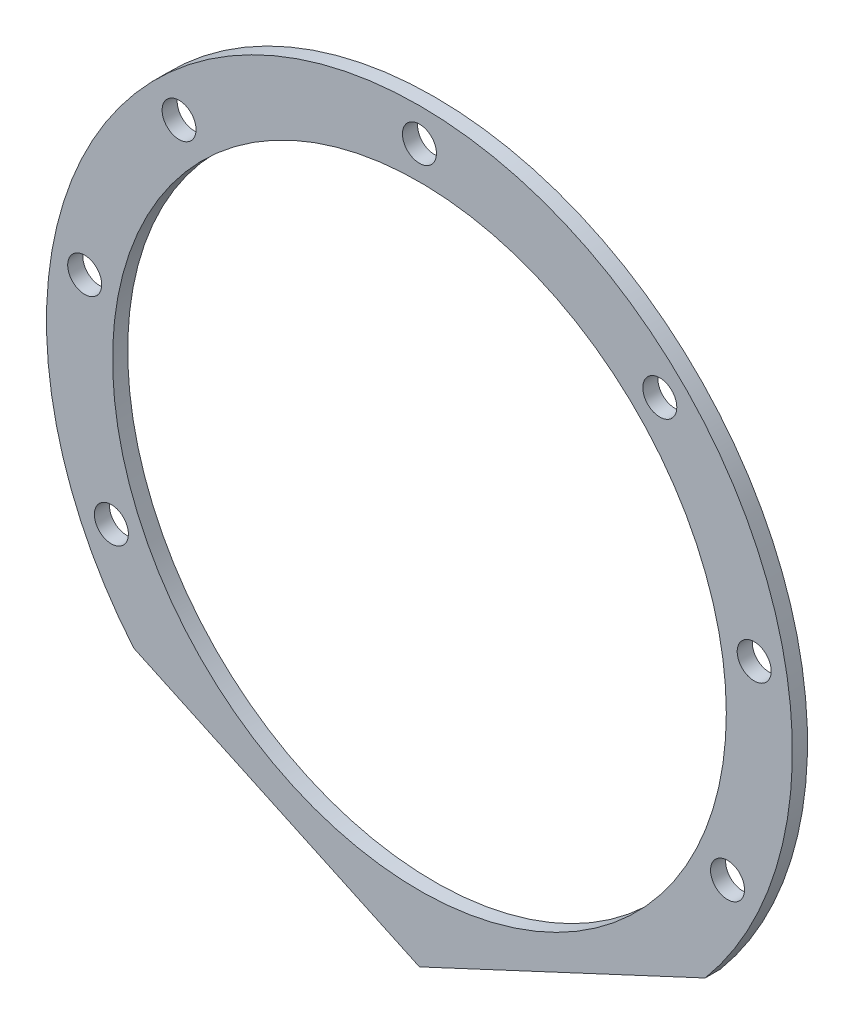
SolidWorks part; units mm, degrees
ref_plane "Plan de face" through (0, 0, 0) normal (0, 0, 1) x (1, 0, 0)
ref_plane "Plan de dessus" through (0, 0, 0) normal (0, 1, 0) x (1, 0, 0)
ref_plane "Plan de droite" through (0, 0, 0) normal (1, 0, 0) x (0, 0, -1)
sketch "Esquisse1" plane through (0, 0, 0) normal (0, 0, 1) x (1, 0, 0)
  line L0 (0, 230.6811) -> (0, -265.3328) construction
  line L1 (-230.6811, -197.5) -> (277.2134, -197.5) construction
  line L2 (0, 0) -> (-258.4766, -120.5296) construction
  line L3 (-260.3724, 45.9107) -> (0, 0) construction
  line L4 (0, 0) -> (-195.6754, 195.6754) construction
  line L5 (0, -197.5) -> (-173.1038, -116.7804)
  line L6 (0, -197.5) -> (173.1038, -116.7804)
  line L7 (0, 0) -> (195.6754, 195.6754) construction
  line L8 (260.3724, 45.9107) -> (0, 0) construction
  line L9 (0, 0) -> (258.4766, -120.5296) construction
  arc A0 (151.2938, -126.9506) -> (-151.2938, -126.9506) centre (0, 0) ccw
  circle A1 centre (0, 0) radius 162.5
  circle A2 centre (0, 0) radius 180 construction
  circle A3 centre (-163.1354, -76.0713) radius 9
  circle A4 centre (-177.2654, 31.2567) radius 9
  circle A5 centre (-127.2792, 127.2792) radius 9
  circle A6 centre (0, 180) radius 9
  circle A7 centre (163.1354, -76.0713) radius 9
  circle A8 centre (177.2654, 31.2567) radius 9
  circle A9 centre (127.2792, 127.2792) radius 9
  dimension "D1" = 325
  dimension "D2" = 395
  dimension "D7" = 360
  dimension "D8" = 18
  dimension "D3" = 45
  dimension "D4" = 35
  dimension "D5" = 35
  dimension "D6" = 25
extrude "Extrusion1" add sketch "Esquisse1" along normal blind 8 contours L6 A0 L5 A8 A1 A3 A4 A5 A6 A7 A9
